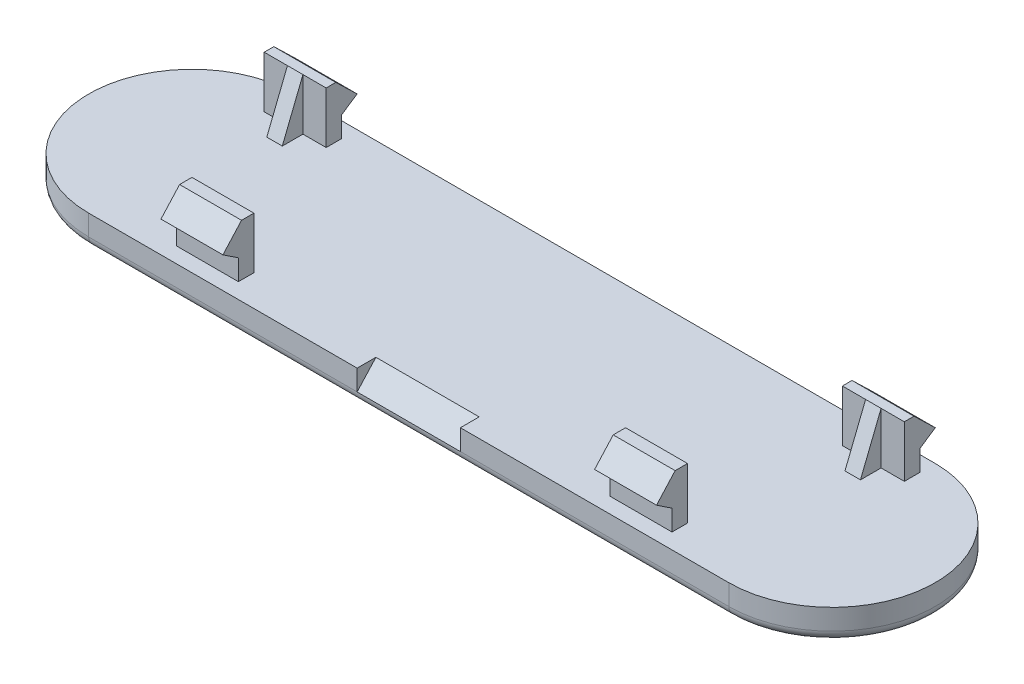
SolidWorks part; units mm, degrees
ref_plane "Спереди" through (0, 0, 0) normal (0, 0, 1) x (1, 0, 0)
ref_plane "Сверху" through (0, 0, 0) normal (0, 1, 0) x (1, 0, 0)
ref_plane "Справа" through (0, 0, 0) normal (1, 0, 0) x (0, 0, -1)
sketch "Эскиз3" plane through (0, 0, 0) normal (0, 1, 0) x (1, 0, 0)
  line L0 (31, 0) -> (-31, 0) construction
  line L1 (31, -10) -> (-31, -10)
  line L2 (31, 10) -> (-31, 10)
  line L3 (-31, 0) -> (-106.8011, 0) construction
  line L4 (-106.8011, 0) -> (102.7607, 0) construction
  arc A0 (31, -10) -> (31, 10) centre (31, 0) ccw
  arc A1 (-31, 10) -> (-31, -10) centre (-31, 0) ccw
  point P2 (0, 0)
  point P10 (-41, 0)
  point P12 (41, 0)
  dimension "D1" = 20
  dimension "D2" = 82
extrude "Бобышка-Вытянуть1" add sketch "Эскиз3" along normal blind 3
fillet "Скругление1" radius 1 4 edges at (0, 0, 10) (-41, 0, 0) (0, 0, -10) (41, 0, 0)
sketch "Эскиз4" plane through (0, 3, 0) normal (0, 1, 0) x (1, 0, 0)
  line L0 (0, 0) -> (0, 17.6758) construction
  line L1 (-24, -7) -> (-18, -7)
  line L2 (-24, -7) -> (-24, -10)
  line L3 (-24, -10) -> (-18, -10)
  line L4 (-18, -7) -> (-18, -10)
  line L5 (-24, -7) -> (-18, -10) construction
  line L6 (-24, -10) -> (-18, -7) construction
  line L7 (0, 17.6758) -> (0, -13.4442) construction
  line L8 (0, -13.4442) -> (0, 0) construction
  line L9 (0, 0) -> (-46.6799, 0) construction
  line L10 (-46.6799, 0) -> (50.3825, 0) construction
  line L11 (-31, -10) -> (31, -10) construction
  line L12 (31, 10) -> (-31, 10) construction
  line L13 (18, -10) -> (24, -10)
  line L14 (18, -10) -> (18, -7)
  line L15 (18, -7) -> (24, -7)
  line L16 (24, -10) -> (24, -7)
  line L17 (18, -10) -> (24, -7) construction
  line L18 (18, -7) -> (24, -10) construction
  line L19 (-31, 10) -> (-25, 10)
  line L20 (-31, 10) -> (-31, 7)
  line L21 (-31, 7) -> (-25, 7)
  line L22 (-25, 10) -> (-25, 7)
  line L23 (-31, 10) -> (-25, 7) construction
  line L24 (-31, 7) -> (-25, 10) construction
  line L26 (25, 7) -> (31, 7)
  line L27 (25, 7) -> (25, 10)
  line L28 (25, 10) -> (31, 10)
  line L29 (31, 7) -> (31, 10)
  line L30 (25, 7) -> (31, 10) construction
  line L31 (25, 10) -> (31, 7) construction
  point P0 (-21, -8.5)
  point P13 (21, -8.5)
  point P18 (-28, 8.5)
  point P25 (28, 8.5)
  dimension "D1" = 18
  dimension "D2" = 6
  dimension "D3" = 0
  dimension "D4" = 3
  dimension "D5" = 18
  dimension "D6" = 6
  dimension "D7" = 0
  dimension "D8" = 3
  dimension "D9" = 25
  dimension "D10" = 0
  dimension "D11" = 6
  dimension "D12" = 3
  dimension "D13" = 25
  dimension "D14" = 6
  dimension "D15" = 0
  dimension "D16" = 3
extrude "Бобышка-Вытянуть2" add sketch "Эскиз4" along normal blind 5
sketch "Эскиз5" plane through (0, 0, -10) normal (0, 0, -1) x (-1, 0, 0)
  line L0 (-31, 3) -> (31, 3) construction
  line L1 (31, 3) -> (53.6444, 3) construction
  line L2 (-25, 8) -> (-25, 3) construction
  line L3 (-31, 3) -> (-25, 3)
  line L4 (-31, 3) -> (-31, 6)
  line L5 (-31, 6) -> (-25, 6)
  line L6 (-25, 3) -> (-25, 6)
  line L7 (31, 8) -> (31, 3) construction
  line L8 (25, 3) -> (31, 3)
  line L9 (25, 3) -> (25, 6)
  line L10 (25, 6) -> (31, 6)
  line L11 (31, 3) -> (31, 6)
  dimension "D1" = 6
  dimension "D2" = 3
  dimension "D3" = 6
  dimension "D4" = 3
extrude "Вырез-Вытянуть1" cut sketch "Эскиз5" against normal blind 1.5
sketch "Эскиз6" plane through (0, 0, 10) normal (0, 0, 1) x (1, 0, 0)
  line L0 (-27.5, 3) -> (42.232, 3) construction
  line L1 (-31, 3) -> (-24, 3) construction
  line L2 (-18, 8) -> (-18, 3) construction
  line L3 (-24, 3) -> (-18, 3)
  line L4 (-24, 3) -> (-24, 6)
  line L5 (-24, 6) -> (-18, 6)
  line L6 (-18, 3) -> (-18, 6)
  line L7 (24, 8) -> (24, 3) construction
  line L8 (18, 3) -> (24, 3)
  line L9 (18, 3) -> (18, 6)
  line L10 (18, 6) -> (24, 6)
  line L11 (24, 3) -> (24, 6)
  point P4 (-24, 3)
  point P5 (-18, 3)
  point P7 (24.9832, 3)
  point P9 (31, 3)
  dimension "D1" = 6
  dimension "D2" = 3
  dimension "D3" = 6
  dimension "D4" = 3
extrude "Вырез-Вытянуть2" cut sketch "Эскиз6" against normal blind 1.5
sketch "Эскиз7" plane through (31, 0, 0) normal (1, 0, 0) x (0, 0, -1)
  line L0 (7.9324, 8) -> (10, 6)
  line L1 (8.5, 6) -> (10, 6) construction
  line L2 (7, 8) -> (10, 8) construction
extrude "Вырез-Вытянуть3" cut sketch "Эскиз7" against normal through all and the other way through all
sketch "Эскиз8" plane through (24, 0, 0) normal (1, 0, 0) x (0, 0, -1)
  line L0 (-8.1985, 8) -> (-10, 6)
  line L1 (-10, 8) -> (-7, 8) construction
  line L3 (-8.5, 6) -> (-10, 6) construction
extrude "Вырез-Вытянуть5" cut sketch "Эскиз8" against normal through all and the other way through all flip side to cut
sketch "Эскиз9" plane through (24, 0, 0) normal (1, 0, 0) x (0, 0, -1)
  line L0 (-10, 6) -> (-8.5, 5)
  line L1 (-8.5, 3) -> (-8.5, 6) construction
  line L2 (-8.5, 6) -> (-10, 6) construction
  line L3 (-10, 6) -> (-8.5, 6)
  line L4 (-8.5, 6) -> (-8.5, 5)
  dimension "D1" = 1
extrude "Бобышка-Вытянуть3" add sketch "Эскиз9" against normal blind 6
sketch "Эскиз10" plane through (31, 0, 0) normal (1, 0, 0) x (0, 0, -1)
  line L0 (10, 6) -> (8.5, 5)
  line L1 (8.5, 6) -> (8.5, 3) construction
  line L2 (8.5, 5) -> (8.5, 6)
  line L3 (8.5, 6) -> (10, 6)
  dimension "D1" = 1
extrude "Бобышка-Вытянуть4" add sketch "Эскиз10" against normal blind 6
sketch "Эскиз12" plane through (-24, 0, 0) normal (-1, 0, 0) x (0, 0, 1)
  line L0 (10, 6) -> (8.5, 5)
  line L1 (8.5, 6) -> (8.5, 3) construction
  line L2 (8.5, 5) -> (8.5, 6)
  line L3 (8.5, 6) -> (10, 6)
  dimension "D1" = 1
extrude "Бобышка-Вытянуть6" add sketch "Эскиз12" against normal blind 6
sketch "Эскиз11" plane through (-31, 0, 0) normal (-1, 0, 0) x (0, 0, 1)
  line L0 (-10, 6) -> (-8.5, 5)
  line L1 (-8.5, 3) -> (-8.5, 6) construction
  line L2 (-8.5, 5) -> (-8.5, 6)
  line L3 (-8.5, 6) -> (-10, 6)
  dimension "D1" = 1
extrude "Бобышка-Вытянуть5" add sketch "Эскиз11" against normal blind 6
sketch "Эскиз13" plane through (0, 3, 0) normal (0, 1, 0) x (1, 0, 0)
  line L0 (0, -19.7916) -> (0, 18.2047) construction
  line L2 (-5, -12.1823) -> (5, -12.1823)
  line L3 (-5, -12.1823) -> (-5, -8.1823)
  line L4 (-5, -8.1823) -> (5, -8.1823)
  line L5 (5, -12.1823) -> (5, -8.1823)
  line L6 (-5, -12.1823) -> (5, -8.1823) construction
  line L7 (-5, -8.1823) -> (5, -12.1823) construction
  point P3 (0, -10.1823)
  dimension "D1" = 10
  dimension "D2" = 4
extrude "Вырез-Вытянуть6" cut sketch "Эскиз13" against normal blind 2
sketch "Эскиз14" plane through (-5, 0, 0) normal (1, 0, 0) x (0, 0, -1)
  line L0 (-8.1823, 3) -> (-10, 1)
  line L1 (-10, 1) -> (-8.1823, 1)
  line L2 (-8.1823, 1) -> (-8.1823, 3)
extrude "Бобышка-Вытянуть7" add sketch "Эскиз14" along normal up to next
sketch "Эскиз15" plane through (0, 3, 0) normal (0, 1, 0) x (1, 0, 0)
  line L0 (-28, 7) -> (-28, 10.5141) construction
  line L1 (-31, 7) -> (-25, 7) construction
  line L3 (-28.75, 7) -> (-27.25, 7)
  line L4 (-28.75, 7) -> (-28.75, 5)
  line L5 (-28.75, 5) -> (-27.25, 5)
  line L6 (-27.25, 7) -> (-27.25, 5)
  dimension "D1" = 1.5
  dimension "D2" = 2
extrude "Бобышка-Вытянуть8" add sketch "Эскиз15" along normal blind 5
sketch "Эскиз16" plane through (0, 3, 0) normal (0, 1, 0) x (1, 0, 0)
  line L0 (28, 7) -> (28, 10.5884) construction
  line L1 (25, 7) -> (31, 7) construction
  line L3 (27.25, 7) -> (28.75, 7)
  line L4 (27.25, 7) -> (27.25, 5)
  line L5 (27.25, 5) -> (28.75, 5)
  line L6 (28.75, 7) -> (28.75, 5)
  dimension "D1" = 2
  dimension "D2" = 1.5
extrude "Бобышка-Вытянуть9" add sketch "Эскиз16" along normal blind 5
sketch "Эскиз17" plane through (0, 3, 0) normal (0, 1, 0) x (1, 0, 0)
  line L0 (-21, -7) -> (-21, -6.6207) construction
  line L1 (-18, -7) -> (-24, -7) construction
  line L3 (-21.75, -7) -> (-20.25, -7)
  line L4 (-21.75, -7) -> (-21.75, -5)
  line L5 (-21.75, -5) -> (-20.25, -5)
  line L6 (-20.25, -7) -> (-20.25, -5)
  dimension "D1" = 1.5
  dimension "D2" = 2
extrude "Бобышка-Вытянуть10" add sketch "Эскиз17" along normal blind 5
sketch "Эскиз18" plane through (0, 3, 0) normal (0, 1, 0) x (1, 0, 0)
  line L0 (21, -7) -> (21, -6.0819) construction
  line L1 (24, -7) -> (18, -7) construction
  line L3 (20.25, -7) -> (21.75, -7)
  line L4 (20.25, -7) -> (20.25, -5)
  line L5 (20.25, -5) -> (21.75, -5)
  line L6 (21.75, -7) -> (21.75, -5)
  dimension "D1" = 1.5
  dimension "D2" = 2
extrude "Бобышка-Вытянуть11" add sketch "Эскиз18" along normal blind 5
sketch "Эскиз19" plane through (21.75, 0, 0) normal (1, 0, 0) x (0, 0, -1)
  line L0 (-7, 8) -> (-5, 3)
  line L1 (-5, 3) -> (-5, 8)
  line L2 (-5, 8) -> (-7, 8)
extrude "Вырез-Вытянуть7" cut sketch "Эскиз19" against normal through all
sketch "Эскиз20" plane through (28.75, 0, 0) normal (1, 0, 0) x (0, 0, -1)
  line L0 (7, 8) -> (5, 3)
  line L1 (5, 3) -> (5, 8)
  line L2 (5, 8) -> (7, 8)
extrude "Вырез-Вытянуть8" cut sketch "Эскиз20" against normal through all
